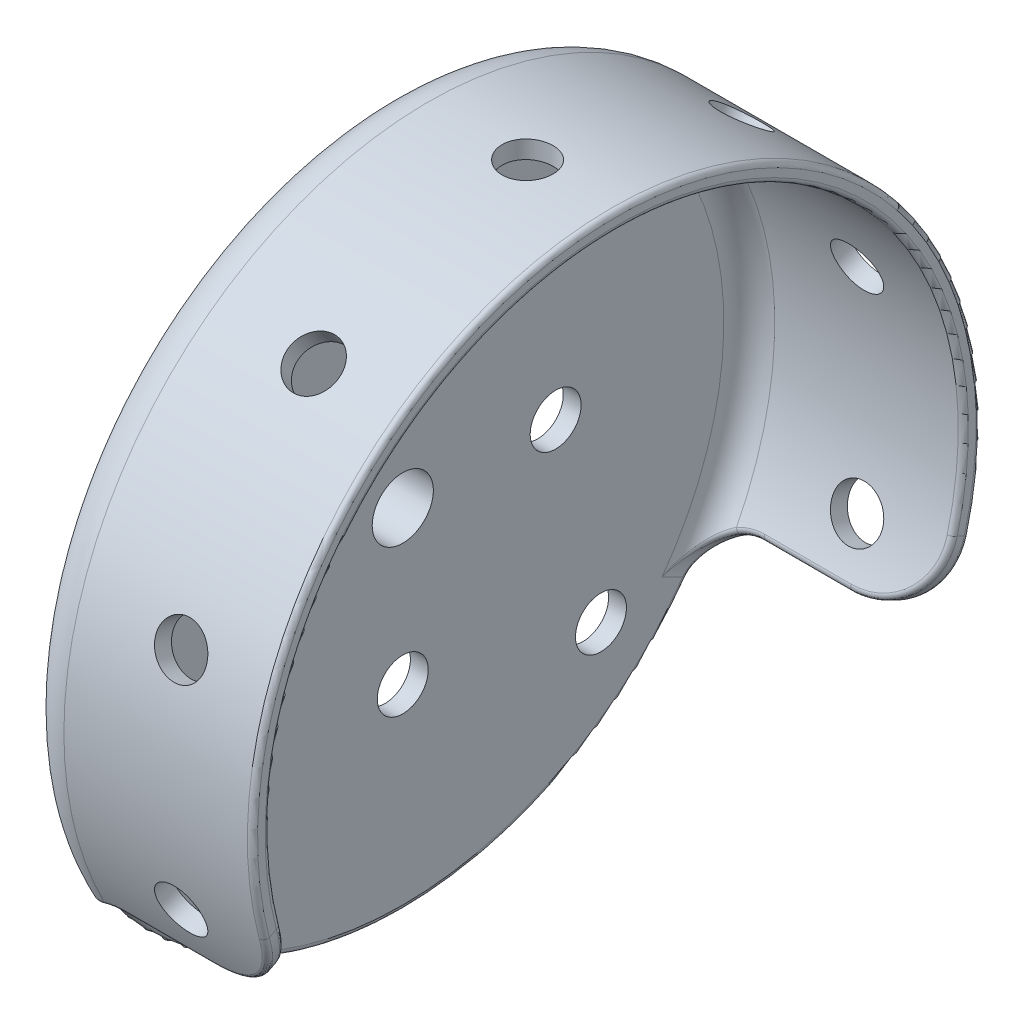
SolidWorks part; units mm, degrees
ref_plane "Front" through (0, 0, 0) normal (0, 0, 1) x (1, 0, 0)
ref_plane "Top" through (0, 0, 0) normal (0, 1, 0) x (1, 0, 0)
ref_plane "Right" through (0, 0, 0) normal (1, 0, 0) x (0, 0, -1)
sketch "Эскиз1" plane through (0, 0, 0) normal (0, 0, 1) x (1, 0, 0)
  line L0 (0, 2) -> (0, 1.2)
  line L1 (0, 2) -> (1, 2)
  line L2 (1, 2) -> (1, 3.5)
  line L3 (0, 4) -> (2.3, 4)
  line L4 (3.3, 5) -> (3.3, 12.6)
  line L5 (12.4, 13.6) -> (5, 13.6)
  line L6 (5, 14.3) -> (12.4, 14.3)
  line L7 (1, 3.5) -> (0, 3.5)
  line L8 (4, 12.6) -> (4, 1.2)
  line L10 (0, 0) -> (10.3632, 0) construction
  line L11 (0, 1.2) -> (4, 1.2)
  line L12 (0, 3.5) -> (0, 4)
  line L13 (12.4, 14.3) -> (12.4, 13.6)
  line L16 (15.2962, 13.95) -> (3, 13.95) construction
  arc A0 (5, 13.6) -> (4, 12.6) centre (5, 12.6) ccw
  arc A1 (5, 14.3) -> (3.3, 12.6) centre (5, 12.6) ccw
  arc A2 (3.3, 5) -> (2.3, 4) centre (2.3, 5) cw
  point P1 (0.5, 3.5)
  dimension "D3" = 1
  dimension "D12" = 1.7
  dimension "D7" = 8.4
  dimension "D13" = 1
  dimension "D2" = 4
  dimension "D4" = 14.3
  dimension "D5" = 1
  dimension "D6" = 3.3
  dimension "D9" = 4
  dimension "D8" = 2
  dimension "D10" = 3.5
  dimension "D11" = 1.2
  dimension "D15" = 13.6
  dimension "D19" = 0.35
revolve "Повернуть1" add sketch "Эскиз1" angle 360 about L10
sketch "Эскиз3" plane through (3.3, 0, 0) normal (-1, 0, 0) x (0, 0, 1)
  circle A0 centre (-6, 0) radius 1
  dimension "D1" = 2
  dimension "D2" = 6
extrude "Вырез-Вытянуть2" cut sketch "Эскиз3" against normal through all
pattern_circular "Круговой массив2" count 4 over 360 about axis through (0, 0, 0) along (1, 0, 0) of "Вырез-Вытянуть2"
sketch "Эскиз4" plane through (4, 0, 0) normal (1, 0, 0) x (0, 0, -1)
  line L0 (0, 0) -> (15.6299, 0) construction
  line L1 (0, 0) -> (12.9196, -6.5829)
  line L2 (0, 0) -> (0, -17.9115) construction
  line L3 (0, 0) -> (-12.9196, -6.5829)
  arc A1 (-12.9196, -6.5829) -> (12.9196, -6.5829) centre (0, 0) ccw
  dimension "D2" = 14.5
  dimension "D1" = 27
extrude "Вырез-Вытянуть3" cut sketch "Эскиз4" along normal through all
fillet "Скругление2" radius 3 2 edges at (12.4, -6.3332, -12.4295) (12.4, -6.3332, 12.4295)
fillet "Скругление3" radius 2 2 edges at (4, -6.0323, -11.8391) (4, -6.0323, 11.8391)
sketch "Эскиз5" plane through (4, 0, 0) normal (1, 0, 0) x (0, 0, -1)
  line L0 (0, 0) -> (-15.5312, -5.0464) construction
  line L1 (0, 0) -> (-16.161, 0) construction
  dimension "D1" = 18
ref_plane "Плоскость1" through (4, 0, 0) normal (0, -0.309, 0.9511) x (1, 0, 0)
sketch "Эскиз6" plane through (4, 0, 0) normal (0, -0.309, 0.9511) x (1, 0, 0)
  line L0 (8.4, -7.7653) -> (8.4, 14.3) construction
  line L1 (0, 0) -> (0, 4.994) construction
  line L2 (0, 0) -> (9.3366, 0) construction
  circle A0 centre (4.9, 0) radius 1
  dimension "D1" = 2
  dimension "D2" = 3.5
extrude "Вырез-Вытянуть4" cut sketch "Эскиз6" along normal through all
pattern_circular "Круговой массив3" count 7 over 216 about axis through (12.4, 0, 0) along (-1, 0, 0) of "Вырез-Вытянуть4"
sketch "Эскиз7" plane through (4, 0, 0) normal (1, 0, 0) x (0, 0, -1)
  line L0 (0, 0) -> (0, -14.9421) construction
  line L1 (0, 0) -> (-8.6531, -8.6531) construction
  circle A0 centre (-7.7782, -7.7782) radius 1
  dimension "D2" = 2
  dimension "D3" = 11
  dimension "D1" = 45
extrude "Вырез-Вытянуть5" cut sketch "Эскиз7" against normal through all
pattern_circular "Круговой массив4" count 4 over 360 about axis through (0, 0, 0) along (1, 0, 0) of "Вырез-Вытянуть5"
sketch "Эскиз8" plane through (4, 0, 0) normal (1, 0, 0) x (0, 0, -1)
  line L0 (0, 0) -> (0, -13.9748) construction
  arc A0 (-11.4155, -8.0611) -> (11.4155, -8.0611) centre (0, 0) ccw construction
ref_plane "Плоскость2" through (4, -13.9748, 0) normal (0, -1, 0) x (-1, 0, 0)
fillet "Скругление4" radius 0.2 19 edges at (4.326, -6.8486, 11.4464) (5.3381, -6.2745, 12.0661) (7.7, -6.1743, 12.1177) (11.7586, -5.1311, 12.5949) (4.326, -6.8486, -11.4464) (5.6296, -6.2051, -12.1019) (7.7, -6.1743, -12.1177) (11.2733, -5.5819, -12.4017) (4.4011, -7.1439, 12.2617) (5.6296, -6.5229, 12.7256) (7.7, -6.4921, 12.7414) (11.2734, -5.8999, 13.0262) (12.4, 14.3, 0) (11.7571, -5.4518, -13.22) (7.7, -6.4921, -12.7414) (5.3381, -6.5923, -12.6898) (4.2191, -7.3578, -12.0397) (12.4, 13.6, 0) (4, -13.9748, 0)
sketch "Эскиз9" plane through (4, 0, 0) normal (1, 0, 0) x (0, 0, -1)
  line L0 (0, 0) -> (-10.9501, 0) construction
  circle A0 centre (-11, 0) radius 0.6
  dimension "D1" = 1.2
  dimension "D2" = 11
extrude "Вырез-Вытянуть6" cut sketch "Эскиз9" against normal through all
